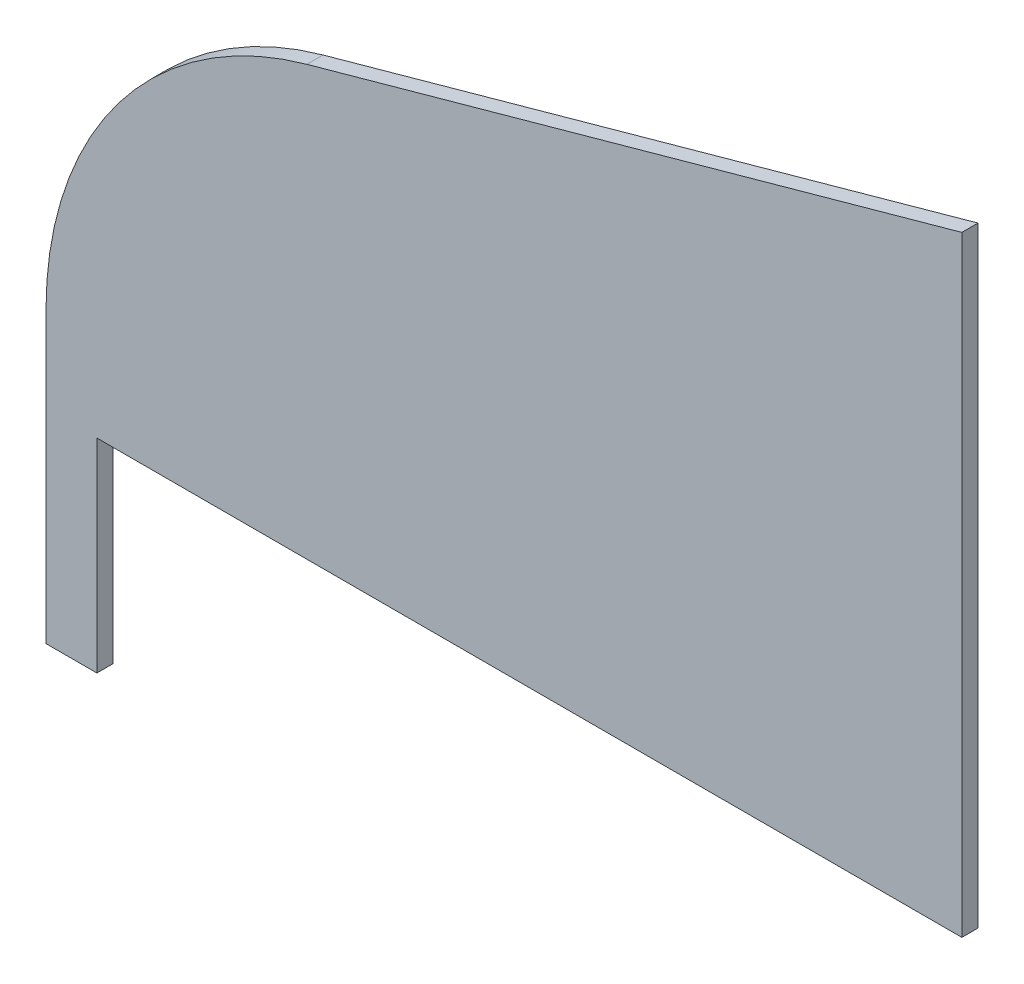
SolidWorks part; units mm, degrees
ref_plane "Front Plane" through (0, 0, 0) normal (0, 0, 1) x (1, 0, 0)
ref_plane "Top Plane" through (0, 0, 0) normal (0, 1, 0) x (1, 0, 0)
ref_plane "Right Plane" through (0, 0, 0) normal (1, 0, 0) x (0, 0, -1)
sketch "Sketch1" plane through (0, 0, 0) normal (0, 0, 1) x (1, 0, 0)
  line L0 (0, 0) -> (0, 70)
  line L2 (0, 0) -> (0, -50)
  line L3 (-170, -90) -> (-180, -90)
  line L4 (-180, -33.206) -> (-180, -90)
  line L6 (-170, -90) -> (-170, -50)
  line L7 (-170, -50) -> (0, -50)
  line L9 (0, 70) -> (-128.7351, 34.2403)
  arc A0 (-128.7351, 34.2403) -> (-180, -33.206) centre (-110, -33.206) ccw
  point P10 (-180, 20)
  point P15 (-180, 20)
  dimension "D7" = 70
  dimension "D1" = 40
  dimension "D2" = 170
  dimension "D3" = 180
  dimension "D4" = 50
  dimension "D5" = 110
  dimension "D6" = 70
extrude "Boss-Extrude1" add sketch "Sketch1" along normal blind 3.175
